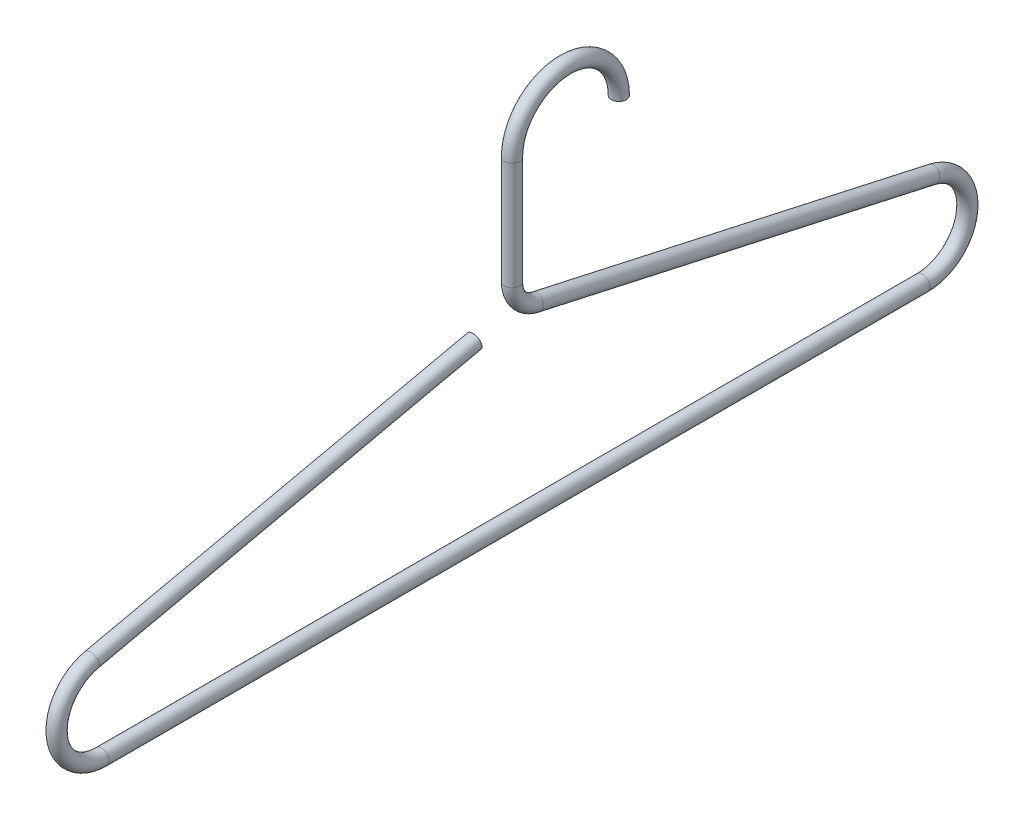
SolidWorks part; units mm, degrees
ref_plane "Front" through (0, 0, 0) normal (0, 0, 1) x (1, 0, 0)
ref_plane "Top" through (0, 0, 0) normal (0, 1, 0) x (1, 0, 0)
ref_plane "Right" through (0, 0, 0) normal (1, 0, 0) x (0, 0, -1)
sketch "Sketch1" plane through (0, 0, 0) normal (1, 0, 0) x (0, 0, -1)
  line L0 (0, 55.1092) -> (0, 9.3984)
  line L1 (9.9572, -3.0019) -> (177.8074, -40.1285)
  line L2 (173.6932, -77.7789) -> (-173.6932, -77.7789)
  line L3 (0, 55.1092) -> (0, -137.465) construction
  line L4 (-177.8074, -40.1285) -> (-15.8778, -4.3114)
  arc A0 (45.217, 55.1092) -> (0, 55.1092) centre (22.6085, 55.1092) ccw
  arc A1 (177.8074, -40.1285) -> (173.6932, -77.7789) centre (173.6932, -58.7289) cw
  arc A2 (9.9572, -3.0019) -> (0, 9.3984) centre (12.7, 9.3984) cw
  arc A3 (-177.8074, -40.1285) -> (-173.6932, -77.7789) centre (-173.6932, -58.7289) ccw
  point P14 (0, 0)
  dimension "D1" = 12.7
  dimension "D2" = 19.05
ref_plane "Plane4" through (0, -4.3114, 15.8778) normal (0, 0.216, -0.9764) x (-0.9109, -0.4029, -0.0891)
sketch "Sketch2" plane through (0, -4.3114, 15.8778) normal (0, 0.216, -0.9764) x (-0.9109, -0.4029, -0.0891)
  circle A0 centre (0, 0) radius 3.175
  dimension "D1" = 6.35
sweep "Sweep1" add profiles "Sketch2" path "Sketch1"
